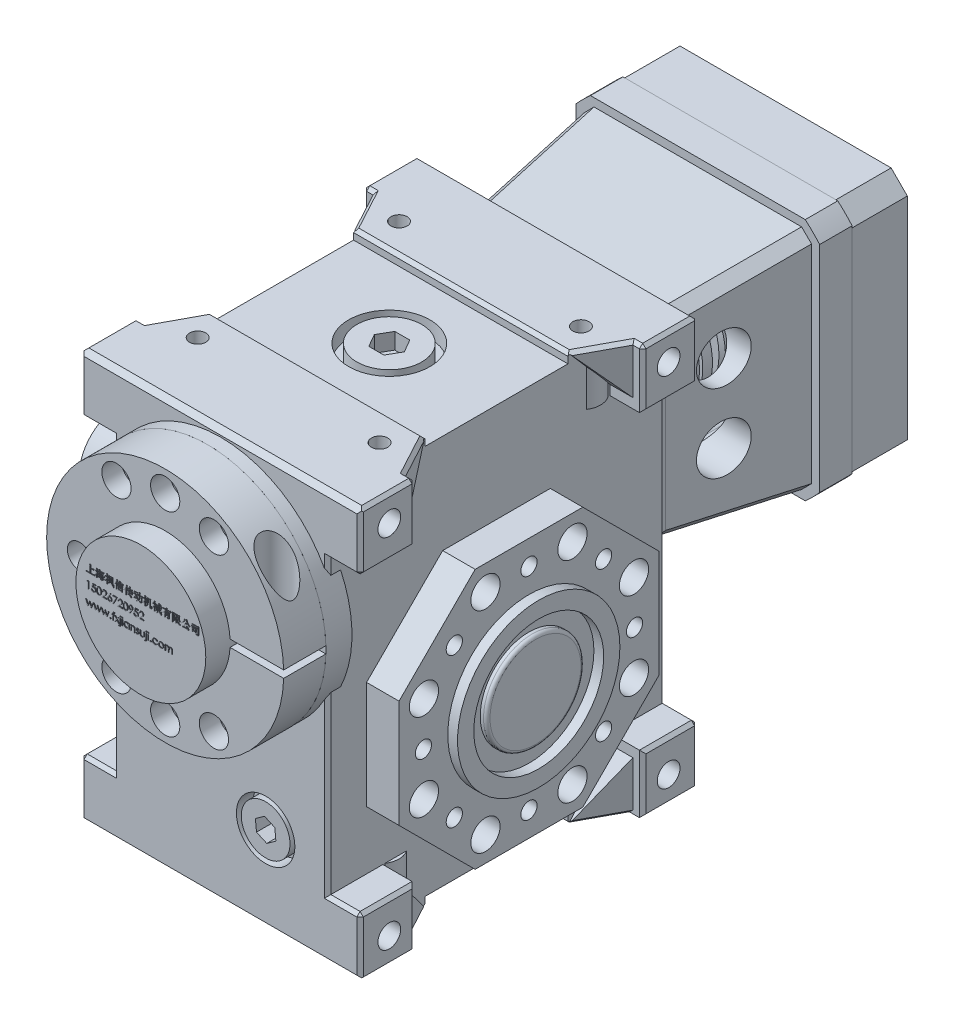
SolidWorks part; units mm, degrees
ref_plane "前视基准面" through (0, 0, 0) normal (0, 0, 1) x (1, 0, 0)
ref_plane "上视基准面" through (0, 0, 0) normal (0, 1, 0) x (1, 0, 0)
ref_plane "右视基准面" through (0, 0, 0) normal (1, 0, 0) x (0, 0, -1)
imported_body "JDLB035-CR箱体-1-solid1"
imported_body "JDLB035-CR箱体-1-solid2"
imported_body "JDLB035-ST75输入法兰-1-solid1"
imported_body "JDLB035-ASR实心轴Φ25-1-solid1"
imported_body "ST75-50-70-M6伺服法兰接口-1-solid1"
imported_body "联轴器BD39-48-12-14锁紧-1-solid1"
imported_body "联轴器BD39-48-12-14锁紧-1-solid2"
imported_body "联轴器BD39-48-12-14锁紧-1-solid3"
imported_body "联轴器BD39-48-12-14锁紧-1-solid4"
imported_body "联轴器BD39-48-12-14锁紧-1-solid5"
imported_body "联轴器BD39-48-12-14锁紧-1-solid6"
imported_body "联轴器BD39-48-12-14锁紧-1-solid7"
sketch "草图1" plane through (-34, 0, 0) normal (-1, 0, 0) x (0, 0, 1)
  line L1 (-24.7123, 63.3777) -> (19.3249, 63.3777)
  line L2 (-24.7123, 63.3777) -> (-24.7123, 54.1592)
  line L3 (-24.7123, 54.1592) -> (19.3249, 54.1592)
  line L4 (19.3249, 63.3777) -> (19.3249, 54.1592)
extrude "切除-拉伸1" cut sketch "草图1" against normal up to surface (1 mm away)
sketch "草图3" plane through (34, 0, 0) normal (1, 0, 0) x (0, 0, -1)
  line L1 (-24.533, 64.2939) -> (23.966, 64.2939)
  line L2 (-24.533, 64.2939) -> (-24.533, 52.9115)
  line L3 (-24.533, 52.9115) -> (23.966, 52.9115)
  line L4 (23.966, 64.2939) -> (23.966, 52.9115)
extrude "切除-拉伸2" cut sketch "草图3" against normal up to surface (1 mm away)
sketch "草图4" plane through (0, 0, 76.5) normal (0, 0, 1) x (1, 0, 0)
  text T0 "上海枫信传动机械有限公司  15026720952  www.fxjiansuji.com" font "Century Gothic" height in points 8
extrude "凸台-拉伸1" add sketch "草图4" along normal blind 0.2
